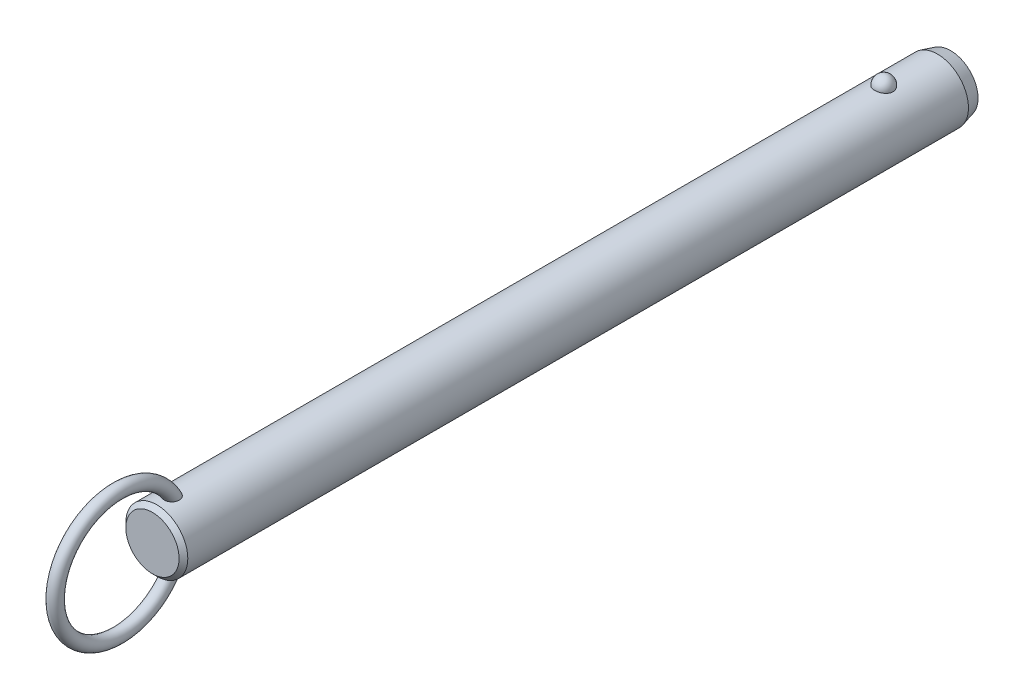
SolidWorks part; units mm, degrees
ref_plane "Front Plane" through (0, 0, 0) normal (0, 0, 1) x (1, 0, 0)
ref_plane "Top Plane" through (0, 0, 0) normal (0, 1, 0) x (1, 0, 0)
ref_plane "Right Plane" through (0, 0, 0) normal (1, 0, 0) x (0, 0, -1)
sketch "Sketch2" plane through (0, 0, 0) normal (0, 0, 1) x (1, 0, 0)
  circle A0 centre (0, 0) radius 7.1
  point P3 (0, 7.1)
  dimension "D1" = 14.2
extrude "Boss-Extrude1" add sketch "Sketch2" along normal blind 157.5
sketch "Sketch3" plane through (0, 0, 0) normal (0, 0, -1) x (-1, 0, 0)
  circle A0 centre (0, 0) radius 7.1
  dimension "D1" = 14.2
extrude "Boss-Extrude2" add sketch "Sketch3" along normal blind 17.4
chamfer "Chamfer1" distance 3 angle 15 1 edges at (-7.1, 0, -17.4)
sketch "Sketch12" plane through (0, 0, 0) normal (1, 0, 0) x (0, 0, -1)
  line L0 (-157.5, 7.1) -> (-157.5, -7.1) construction
  point P0 (-157.5, 0)
sketch "Sketch13" plane through (0, 0, 0) normal (1, 0, 0) x (0, 0, -1)
  circle A0 centre (-173.35, 0) radius 15.85
  point P2 (-157.5, 0)
  dimension "D1" = 31.7
sketch "Sketch14" plane through (0, 0, 0) normal (0, 1, 0) x (1, 0, 0)
  circle A0 centre (0, -159) radius 1.5
  point P2 (0, -157.5)
  dimension "D1" = 3
sweep "Sweep1" add profiles "Sketch14" path "Sketch13"
sketch "Sketch15" plane through (0, 0, 157.5) normal (0, 0, 1) x (1, 0, 0)
  circle A0 centre (0, 0) radius 7.1
  dimension "D1" = 14.2
extrude "Boss-Extrude3" add sketch "Sketch15" along normal blind 7.92
chamfer "Chamfer2" distance 1 angle 45 1 edges at (7.1, 0, 165.42)
sketch "Sketch18" plane through (0, 0, 0) normal (1, 0, 0) x (0, 0, -1)
  line L0 (14.4, 7.1) -> (-159.1792, 7.1) construction
  line L1 (2.1, 9.2) -> (2.1, 5)
  line L2 (-159.1792, -7.1) -> (14.4, -7.1) construction
  arc A0 (2.1, 9.2) -> (2.1, 5) centre (2.1, 7.1) ccw
  point P4 (0, 7.1)
  dimension "D1" = 16.3
revolve "Revolve1" add sketch "Sketch18" angle 360 about L1
